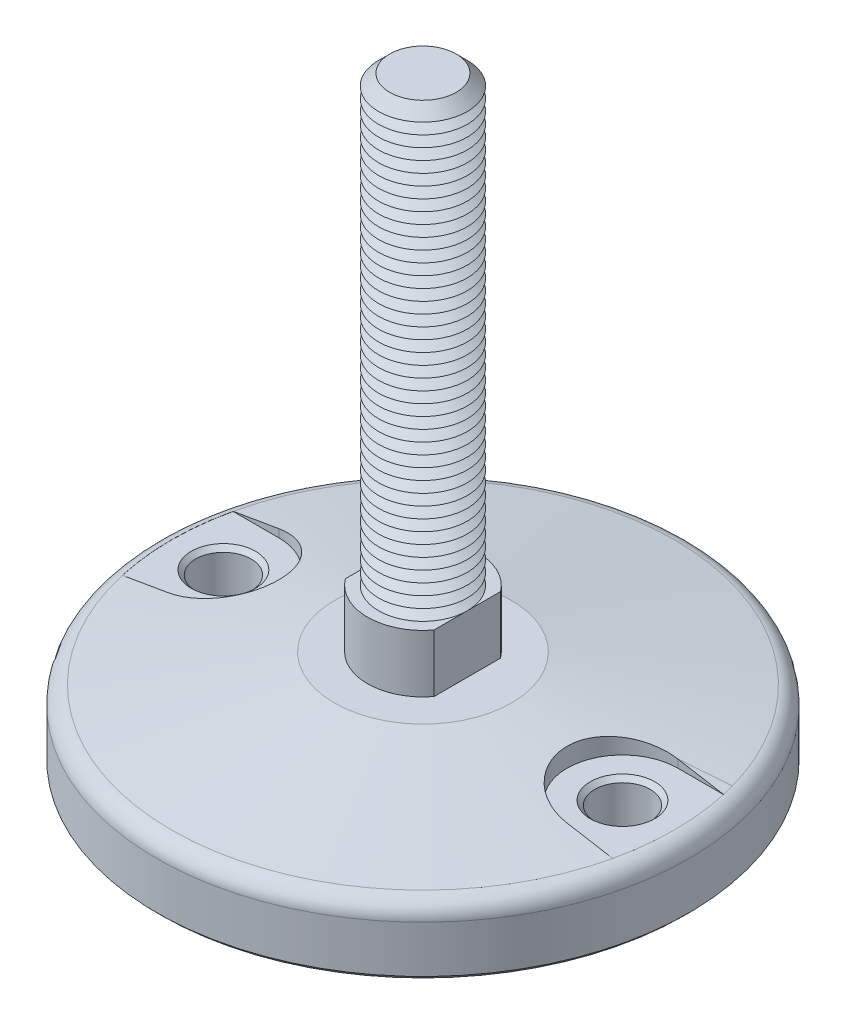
SolidWorks part; units mm, degrees
ref_plane "Front Plane" through (0, 0, 0) normal (0, 0, 1) x (1, 0, 0)
ref_plane "Top Plane" through (0, 0, 0) normal (0, 1, 0) x (1, 0, 0)
ref_plane "Right Plane" through (0, 0, 0) normal (1, 0, 0) x (0, 0, -1)
sketch "Sketch1" plane through (0, 0, 0) normal (1, 0, 0) x (0, 0, -1)
  line L0 (0, 61.3389) -> (0, -58.404) construction
sketch "Sketch2" plane through (0, 0, 0) normal (1, 0, 0) x (0, 0, -1)
  line L0 (0, 0) -> (-20, 0)
  line L1 (-20, 0) -> (-60, -7.0531)
  line L2 (-60, -7.0531) -> (-60, -22)
  line L3 (-60, -22) -> (0, -22)
  line L4 (0, 61.3389) -> (0, -58.404) construction
  line L5 (0, -22) -> (0, 0)
  dimension "D1" = 22
  dimension "D2" = 60
  dimension "D3" = 20
  dimension "D4" = 10
revolve "Revolve1" add sketch "Sketch2" angle 360 about L0
fillet "Fillet1" radius 4 1 edges at (0, -7.0531, 60)
sketch "Sketch3" plane through (0, 0, 0) normal (0, 1, 0) x (1, 0, 0)
  circle A0 centre (0, 0) radius 12.5
  dimension "D1" = 25
extrude "Boss-Extrude1" add sketch "Sketch3" along normal blind 13
sketch "Sketch4" plane through (0, 13, 0) normal (0, 1, 0) x (1, 0, 0)
  line L0 (-10, 7.5) -> (-10, -7.5)
  line L2 (10, -7.5) -> (10, 7.5)
  arc A0 (-10, 7.5) -> (-10, -7.5) centre (0, 0) ccw
  circle A1 centre (0, 0) radius 12.5 construction
  arc A2 (10, -7.5) -> (10, 7.5) centre (0, 0) ccw
  dimension "D1" = 20
extrude "Cut-Extrude1" cut sketch "Sketch4" against normal blind 13
sketch "Sketch5" plane through (0, 13, 0) normal (0, 1, 0) x (1, 0, 0)
  circle A0 centre (0, 0) radius 10
  dimension "D1" = 20
extrude "Boss-Extrude2" add sketch "Sketch5" along normal blind 100
chamfer "Chamfer1" distance 2.5 angle 45 1 edges at (0, 113, 10)
sketch "Sketch6" plane through (0, 0, 0) normal (1, 0, 0) x (0, 0, -1)
  line L0 (-10, 13) -> (-7.8349, 14.25)
  line L1 (-7.8349, 14.25) -> (-10, 15.5)
  line L2 (-10, 110.5) -> (-10, 13) construction
  line L3 (-10, 15.5) -> (-10, 13)
  dimension "D1" = 2.5
revolve "Cut-Revolve1" cut sketch "Sketch6" angle 360 about L0
pattern_linear "LPattern1" count 39 spacing 2.5 along (0, 1, 0) of "Cut-Revolve1"
sketch "Sketch8" plane through (0, 0, 0) normal (0, 1, 0) x (1, 0, 0)
  line L0 (-45, 12.5) -> (-55.2994, 12.5)
  line L1 (-45, -12.5) -> (-55.2994, -12.5)
  arc A1 (-55.2994, 12.5) -> (-55.2994, -12.5) centre (0, 0) ccw
  circle A2 centre (0, 0) radius 56.6946 construction
  arc A3 (-45, -12.5) -> (-45, 12.5) centre (-45, 0) ccw
  point P3 (-45, 0)
  point P11 (0, 0)
  dimension "D1" = 45
  dimension "D2" = 25
extrude "Cut-Extrude4" cut sketch "Sketch8" against normal blind 6.5
sketch "Sketch10" plane through (0, -6.5, 0) normal (0, 1, 0) x (1, 0, 0)
  circle A0 centre (-45, 0) radius 6.25
  dimension "D1" = 12.5
extrude "Cut-Extrude5" cut sketch "Sketch10" against normal up to surface (15.5 mm away)
chamfer "Chamfer2" distance 1 angle 45 2 edges at (-45, -22, -6.25) (-45, -6.5, 6.25)
mirror "Mirror1" about plane through (0, 0, 0) normal (1, 0, 0) of "Chamfer2", "Cut-Extrude5", "Cut-Extrude4"
chamfer "Chamfer3" distance 1 angle 45 1 edges at (0, -22, 60)
